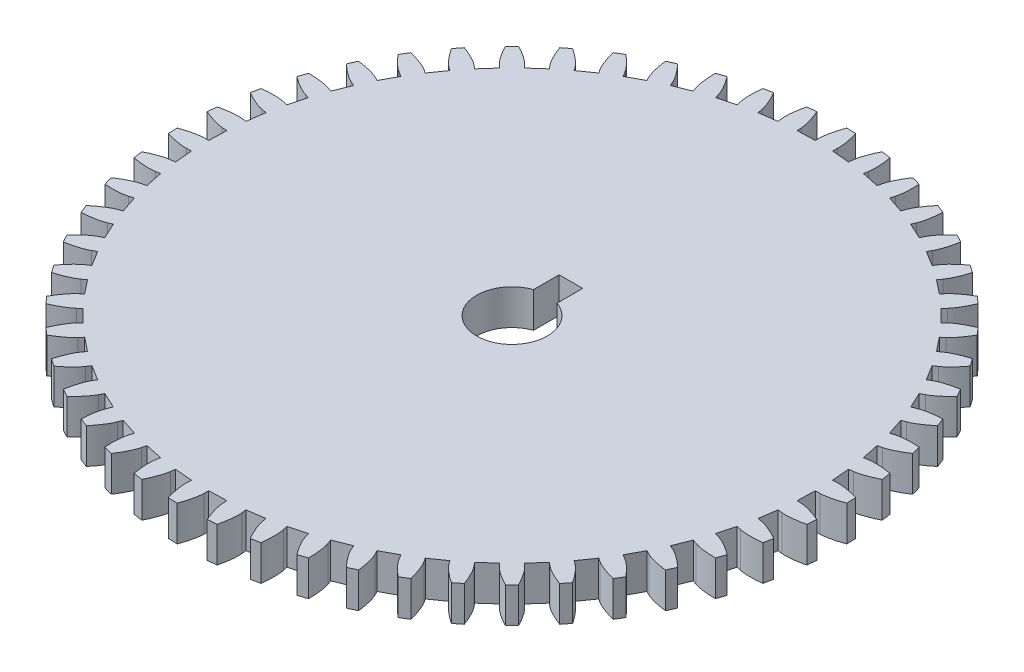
SolidWorks part; units mm, degrees
ref_plane "Front Plane" through (0, 0, 0) normal (0, 0, 1) x (1, 0, 0)
ref_plane "Top Plane" through (0, 0, 0) normal (0, 1, 0) x (1, 0, 0)
ref_plane "Right Plane" through (0, 0, 0) normal (1, 0, 0) x (0, 0, -1)
sketch "Sketch1" plane through (0, 0, 0) normal (0, 1, 0) x (1, 0, 0)
  line L0 (0, 0) -> (0, 13.07) construction
  line L1 (0, 0) -> (-13.07, 0) construction
  line L2 (0, 0) -> (-13.9941, -0.4072) construction
  line L3 (0, 0) -> (-13.0479, -0.76) construction
  line L4 (0, 0) -> (-12.9816, -1.5173) construction
  circle A0 centre (0, 0) radius 13.5 construction
  circle A1 centre (0, 0) radius 13.07 construction
  circle A2 centre (0, 0) radius 12.875 construction
  circle A3 centre (0, 0) radius 14 construction
  spline S0 degree 4 poles (-13.07, 0) (-13.0934, 0) (-13.159, -0.0024) (-13.2826, -0.0165) (-13.4823, -0.0528) (-13.7329, -0.1186) (-14.0509, -0.2255) (-14.416, -0.3792) (-14.8056, -0.5763) (-15.2147, -0.8202) (-15.6083, -1.089) (-15.9863, -1.3794) (-16.3486, -1.689) (-16.7696, -2.0855) (-17.2484, -2.5928) (-17.7673, -3.2241) (-18.3053, -3.9903) (-18.7955, -4.8083) (-19.2294, -5.6571) (-19.5609, -6.4231) (-19.8115, -7.0919) (-19.9984, -7.6585) (-20.1349, -8.113) (-20.2896, -8.6921) (-20.4229, -9.2655) (-20.5361, -9.8612) (-20.6467, -10.5508) (-20.7203, -11.1718) (-20.7717, -11.7133) (-20.813, -12.4759) (-20.8232, -12.8683) (-20.8284, -13.4798) (-20.8173, -13.7585) (-20.8125, -14.0056) (-20.8079, -14.0796) (-20.8059, -14.1331) (-20.805, -14.1619) knots 0 0 0 0 0 0.005377 0.015084 0.028532 0.04661 0.064855 0.092111 0.119476 0.146842 0.174209 0.201575 0.228941 0.256307 0.307035 0.361767 0.4165 0.471232 0.525964 0.580697 0.608063 0.635429 0.662795 0.690161 0.744894 0.77226 0.799626 0.854358 0.881725 0.909091 0.954545 0.977273 0.988636 0.994318 1 1 1 1 1 construction
  spline S1 degree 4 poles (-13.07, 0) (-13.0934, 0) (-13.159, -0.0024) (-13.2826, -0.0165) (-13.4823, -0.0528) (-13.7329, -0.1186) (-14.0509, -0.2255) (-14.416, -0.3792) (-14.8056, -0.5763) (-15.2147, -0.8202) (-15.6083, -1.089) (-15.9863, -1.3794) (-16.3486, -1.689) (-16.7696, -2.0855) (-17.2484, -2.5928) (-17.7673, -3.2241) (-18.3053, -3.9903) (-18.7955, -4.8083) (-19.2294, -5.6571) (-19.5609, -6.4231) (-19.8115, -7.0919) (-19.9984, -7.6585) (-20.1349, -8.113) (-20.2896, -8.6921) (-20.4229, -9.2655) (-20.5361, -9.8612) (-20.6467, -10.5508) (-20.7203, -11.1718) (-20.7717, -11.7133) (-20.8009, -12.2521) (-20.81, -12.4698) (-20.8136, -12.578) knots 0 0 0 0 0 0.005377 0.015084 0.028532 0.04661 0.064855 0.092111 0.119476 0.146842 0.174209 0.201575 0.228941 0.256307 0.307035 0.361767 0.4165 0.471232 0.525964 0.580697 0.608063 0.635429 0.662795 0.690161 0.744894 0.77226 0.799626 0.854358 0.881725 0.909091 0.909091 0.909091 0.909091 0.909091
  dimension "D1" = 28
  dimension "D2" = 27
  dimension "D3" = 26.14
  dimension "D4" = 25.75
  dimension "D5" = 13.07
  dimension "D6" = 1.667
  dimension "D7" = 3.333
  dimension "D8" = 6.667
sketch "Sketch2" plane through (0, 0, 0) normal (0, 1, 0) x (1, 0, 0)
  line L0 (0, 0) -> (-13.9941, -0.4072) construction
  line L1 (0, 0) -> (-13.9941, -0.4072) construction
  line L2 (0, 0) -> (-13.0479, -0.76) construction
  line L3 (0, 0) -> (-13.07, 0) construction
  line L4 (0, 0) -> (-12.9816, -1.5173) construction
  line L5 (0, 0) -> (-13.0479, -0.76) construction
  line L6 (0, 0) -> (-13.07, 0) construction
  line L7 (0, 0) -> (-12.9816, -1.5173) construction
  line L8 (-13.0479, -0.76) -> (-12.8532, -0.7486)
  line L9 (-12.8532, -0.7486) -> (-12.7879, -1.4947)
  line L10 (-12.7879, -1.4947) -> (-12.9816, -1.5173) construction
  line L11 (-12.7879, -1.4947) -> (-1.4899, -0.1741)
  line L12 (-13.07, 0) -> (-1.5, 0)
  circle A0 centre (0, 0) radius 12.875 construction
  circle A1 centre (0, 0) radius 13.07 construction
  circle A2 centre (0, 0) radius 13.5 construction
  circle A3 centre (0, 0) radius 14 construction
  circle A4 centre (0, 0) radius 12.875 construction
  circle A5 centre (0, 0) radius 13.07 construction
  circle A6 centre (0, 0) radius 13.5 construction
  circle A7 centre (0, 0) radius 14 construction
  arc A8 (-13.987, -0.6025) -> (-13.9984, -0.2118) centre (0, 0) cw
  circle A11 centre (0, 0) radius 1.5 construction
  arc A12 (-1.5, 0) -> (-1.4899, -0.1741) centre (0, 0) ccw
  spline S0 degree 4 poles (-40.6787, -999.6181) (-9.6361, -24.5688) (-10.519, -0.5584) (-12.044, 0.2089) (-13.4823, -0.0528) (-13.7329, -0.1186) (-14.0509, -0.2255) (-14.416, -0.3792) (-14.8056, -0.5763) (-15.2147, -0.8202) (-15.6083, -1.089) (-15.9863, -1.3794) (-16.3486, -1.689) (-16.7696, -2.0855) (-17.2484, -2.5928) (-17.7673, -3.2241) (-18.3053, -3.9903) (-18.7955, -4.8083) (-19.2294, -5.6571) (-19.5609, -6.4231) (-19.8115, -7.0919) (-19.9984, -7.6585) (-20.1349, -8.113) (-20.2896, -8.6921) (-20.4229, -9.2655) (-20.5361, -9.8612) (-20.6467, -10.5508) (-20.7203, -11.1718) (-20.9158, -13.2339) (-20.8598, -17.3367) (-19.3107, 17.6341) (-52.9459, -1012.0366) knots -0.289109 -0.289109 -0.289109 -0.289109 -0.289109 0.005377 0.015084 0.028532 0.04661 0.064855 0.092111 0.119476 0.146842 0.174209 0.201575 0.228941 0.256307 0.307035 0.361767 0.4165 0.471232 0.525964 0.580697 0.608063 0.635429 0.662795 0.690161 0.744894 0.77226 0.799626 0.854358 0.881725 1.293326 1.293326 1.293326 1.293326 1.293326 only from (-13.07, 0) to (-20.8136, -12.578) construction
  spline S1 degree 4 poles (-13.07, 0) (-13.0934, 0) (-13.159, -0.0024) (-13.2826, -0.0165) (-13.4823, -0.0528) (-13.6911, -0.1076) (-13.8562, -0.1607) (-13.9644, -0.1993) (-13.9984, -0.2118) knots 0 0 0 0 0 0.005377 0.015084 0.028532 0.04661 0.054928 0.054928 0.054928 0.054928 0.054928
  spline S2 degree 4 poles (-13.0479, -0.76) (-13.0713, -0.7613) (-13.1369, -0.7627) (-13.2611, -0.7559) (-13.4625, -0.7312) (-13.6742, -0.6887) (-13.8421, -0.6453) (-13.9524, -0.613) (-13.987, -0.6025) knots 0 0 0 0 0 0.005377 0.015084 0.028532 0.04661 0.054928 0.054928 0.054928 0.054928 0.054928
  point P21 (-12.8532, -0.7486)
  point P24 (-12.7879, -1.4947)
  dimension "D2" = 3
extrude "Boss-Extrude1" add sketch "Sketch2" along normal blind 1.5
pattern_circular "CirPattern1" count 54 over 360 of "Boss-Extrude1"
sketch "Sketch3" plane through (0, 1.5, 0) normal (0, 1, 0) x (1, 0, 0)
  line L1 (0.5, 0.5) -> (-0.5, 0.5)
  line L2 (0.5, 0.5) -> (0.5, 2.5)
  line L3 (0.5, 2.5) -> (-0.5, 2.5)
  line L4 (-0.5, 0.5) -> (-0.5, 2.5)
  line L5 (0.5, 0.5) -> (-0.5, 2.5) construction
  line L6 (0.5, 2.5) -> (-0.5, 0.5) construction
  circle A0 centre (0, 0) radius 1.5 construction
  point P0 (0, 1.5)
  dimension "D1" = 2
  dimension "D2" = 1
extrude "Cut-Extrude1" cut sketch "Sketch3" against normal up to surface (1.5 mm away)
equation "\"Module\"= .5"
equation "\"Number of Teeth\" = 54"
equation "\"Pressure Angle\"= 14.5deg"
equation "\"Pitch Diameter\"= \"Number of Teeth\" * \"Module\""
equation "\"Circular Pitch\"= pi * \"Module\""
equation "\"Addendum\"= \"Module\""
equation "\"Dedendum\"= 1.25 * \"Module\""
equation "\"Base Diameter\"= \"Pitch Diameter\" * cos ( \"Pressure Angle\" )"
equation "\"Base Radius\"= \"Base Diameter\" / 2"
equation "\"Width\"= 1.5"
equation "\"Outside Diameter\"= \"Pitch Diameter\" + 2 * \"Addendum\""
equation "\"D1@Sketch1\"=\"Outside Diameter\""
equation "\"D3@Sketch1\"=\"Base Diameter\""
equation "\"Root Diameter\"= \"Pitch Diameter\" - 2 * \"Dedendum\""
equation "\"D4@Sketch1\"=\"Root Diameter\""
equation "\"Tooth Angle\"= 360 / \"Number of Teeth\""
equation "\"D6@Sketch1\"=\"Tooth Angle\"/4"
equation "\"D7@Sketch1\"=\"Tooth Angle\"/2"
equation "\"D8@Sketch1\"=\"Tooth Angle\""
equation "\"D2@Sketch1\" = \"Pitch Diameter\""
equation "\"Shaft Diameter\"= 3"
equation "\"D1@CirPattern1\" = \"Number of Teeth\""
equation "\"D2@Sketch2\"= \"Shaft Diameter\""
equation "\"D1@Boss-Extrude1\" = \"Width\""
